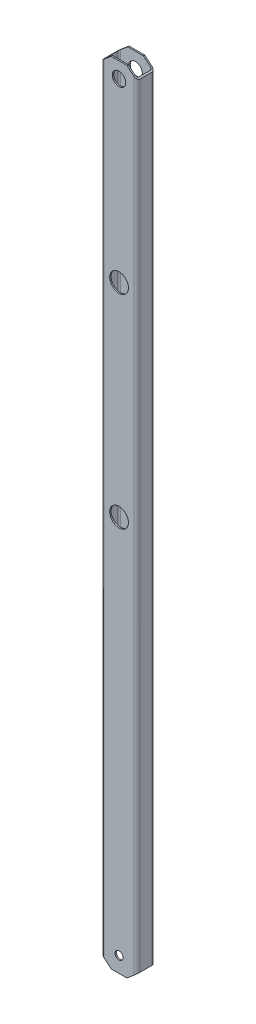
SolidWorks part; units mm, degrees
ref_plane "Piano frontale" through (0, 0, 0) normal (0, 0, 1) x (1, 0, 0)
ref_plane "Piano superiore" through (0, 0, 0) normal (0, 1, 0) x (1, 0, 0)
ref_plane "Piano destro" through (0, 0, 0) normal (1, 0, 0) x (0, 0, -1)
sketch "Schizzo1" plane through (0, 0, 0) normal (1, 0, 0) x (0, 0, -1)
  line L0 (0, 885) -> (0, -885)
  point P3 (0, 0)
  dimension "D1" = 1770
other "Tubo rettangolare 80 X 40 X 3.0(2)"
ref_plane "Piano1" through (0, 885, 0) normal (0, -1, 0) x (0, 0, -1)
sketch "Sketch15" plane through (0, 885, 0) normal (0, -1, 0) x (0, 0, -1)
  line L0 (-13.6, -37) -> (13.6, -37)
  line L1 (-17, -33.6) -> (-17, 33.6)
  line L2 (13.6, 37) -> (-13.6, 37)
  line L3 (17, 33.6) -> (17, -33.6)
  line L4 (-13.6, -40) -> (13.6, -40)
  line L5 (-20, -33.6) -> (-20, 33.6)
  line L6 (13.6, 40) -> (-13.6, 40)
  line L7 (20, 33.6) -> (20, -33.6)
  line L8 (-20, 0) -> (-17, 0) construction
  line L9 (-17, 0) -> (17, 0) construction
  line L10 (17, 0) -> (20, 0) construction
  line L11 (0, 40) -> (0, 37) construction
  line L12 (0, 37) -> (0, -37) construction
  line L13 (0, -37) -> (0, -40) construction
  arc A0 (20, 33.6) -> (13.6, 40) centre (13.6, 33.6) ccw
  arc A1 (13.6, -40) -> (20, -33.6) centre (13.6, -33.6) ccw
  arc A2 (-20, -33.6) -> (-13.6, -40) centre (-13.6, -33.6) ccw
  arc A3 (-13.6, 40) -> (-20, 33.6) centre (-13.6, 33.6) ccw
  arc A4 (-13.6, 37) -> (-17, 33.6) centre (-13.6, 33.6) ccw
  arc A5 (17, 33.6) -> (13.6, 37) centre (13.6, 33.6) ccw
  arc A6 (13.6, -37) -> (17, -33.6) centre (13.6, -33.6) ccw
  arc A7 (-17, -33.6) -> (-13.6, -37) centre (-13.6, -33.6) ccw
  point P6 (-20, 40)
  point P33 (-20, -40)
  point P34 (20, -40)
  point P36 (20, 40)
  point P37 (0, 0)
  dimension "D1" = 6.4
  dimension "Thickness" = 3
  dimension "V_leg" = 80
  dimension "H_leg" = 40
sketch "Schizzo8" plane through (0, 0, 20) normal (0, 0, 1) x (1, 0, 0)
  line L0 (-40, 866.1203) -> (-17.5, 885)
  line L1 (-40, -885) -> (-40, 885) construction
  line L2 (44, 885) -> (-44, 885) construction
  line L3 (-17.5, 885) -> (-40, 885)
  line L4 (-40, 885) -> (-40, 866.1203)
  line L5 (0, 0) -> (0, 885) construction
  line L6 (33.6, 885) -> (-33.6, 885) construction
  line L7 (17.5, 885) -> (40, 885)
  line L8 (40, 866.1203) -> (17.5, 885)
  line L9 (40, 885) -> (40, 866.1203)
  line L10 (0, 0) -> (40, 0) construction
  line L11 (40, -885) -> (40, 885) construction
  line L12 (40, -866.1203) -> (17.5, -885)
  line L13 (40, -885) -> (40, -866.1203)
  line L14 (17.5, -885) -> (40, -885)
  line L15 (-17.5, -885) -> (-40, -885)
  line L16 (-40, -866.1203) -> (-17.5, -885)
  line L17 (-40, -885) -> (-40, -866.1203)
  line L18 (33.6, -885) -> (-33.6, -885) construction
  circle A0 centre (0, 850) radius 15
  circle A3 centre (0, 0) radius 21
  circle A4 centre (0, -850) radius 9
  dimension "D3" = 30
  dimension "D5" = 42
  dimension "D6" = 18
  dimension "D1" = 230
  dimension "D2" = 35
  dimension "D4" = 35
  dimension "D7" = 35
extrude "Taglio-Estrusione1" cut sketch "Schizzo8" against normal up to surface (40 mm away)
sketch "Schizzo9" plane through (0, 0, 20) normal (0, 0, 1) x (1, 0, 0)
  line L0 (17.5, 885) -> (-17.5, 885) construction
  circle A0 centre (0, 455) radius 21
  dimension "D2" = 42
  dimension "D1" = 430
extrude "Taglio-Estrusione3" cut sketch "Schizzo9" against normal up to surface (40 mm away)
sketch "Linee di piegatura1" [suppressed] plane through (0, 0, 0) normal (0, 1, 0) x (1, 0, 0)
sketch "Casella di contorno1" [suppressed] plane through (0, 0, 0) normal (0, 1, 0) x (1, 0, 0)
sketch "Sketch11" plane through (0, 885, 0) normal (0, -1, 0) x (0, 0, -1)
  line L0 (-9, -47) -> (9, -47)
  line L1 (-12, -44) -> (-12, 44)
  line L2 (9, 47) -> (-9, 47)
  line L3 (12, 44) -> (12, -44)
  line L4 (-9, -50) -> (9, -50)
  line L5 (-15, -44) -> (-15, 44)
  line L6 (9, 50) -> (-9, 50)
  line L7 (15, 44) -> (15, -44)
  line L8 (-15, 0) -> (-12, 0) construction
  line L9 (-12, 0) -> (12, 0) construction
  line L10 (12, 0) -> (15, 0) construction
  line L11 (0, 50) -> (0, 47) construction
  line L12 (0, 47) -> (0, -47) construction
  line L13 (0, -47) -> (0, -50) construction
  arc A0 (15, 44) -> (9, 50) centre (9, 44) ccw
  arc A1 (9, -50) -> (15, -44) centre (9, -44) ccw
  arc A2 (-15, -44) -> (-9, -50) centre (-9, -44) ccw
  arc A3 (-9, 50) -> (-15, 44) centre (-9, 44) ccw
  arc A4 (-9, 47) -> (-12, 44) centre (-9, 44) ccw
  arc A5 (12, 44) -> (9, 47) centre (9, 44) ccw
  arc A6 (9, -47) -> (12, -44) centre (9, -44) ccw
  arc A7 (-12, -44) -> (-9, -47) centre (-9, -44) ccw
  point P6 (-15, 50)
  point P33 (-15, -50)
  point P34 (15, -50)
  point P36 (15, 50)
  point P37 (0, 0)
  dimension "D1" = 6
  dimension "Thickness" = 3
  dimension "V_leg" = 100
  dimension "H_leg" = 30
equation "\"Lam_vern\"= 2 * ( \"SW-Massa\" / \"SW-Densità\" ) / ( \"Spessore\" / 1000 )"
